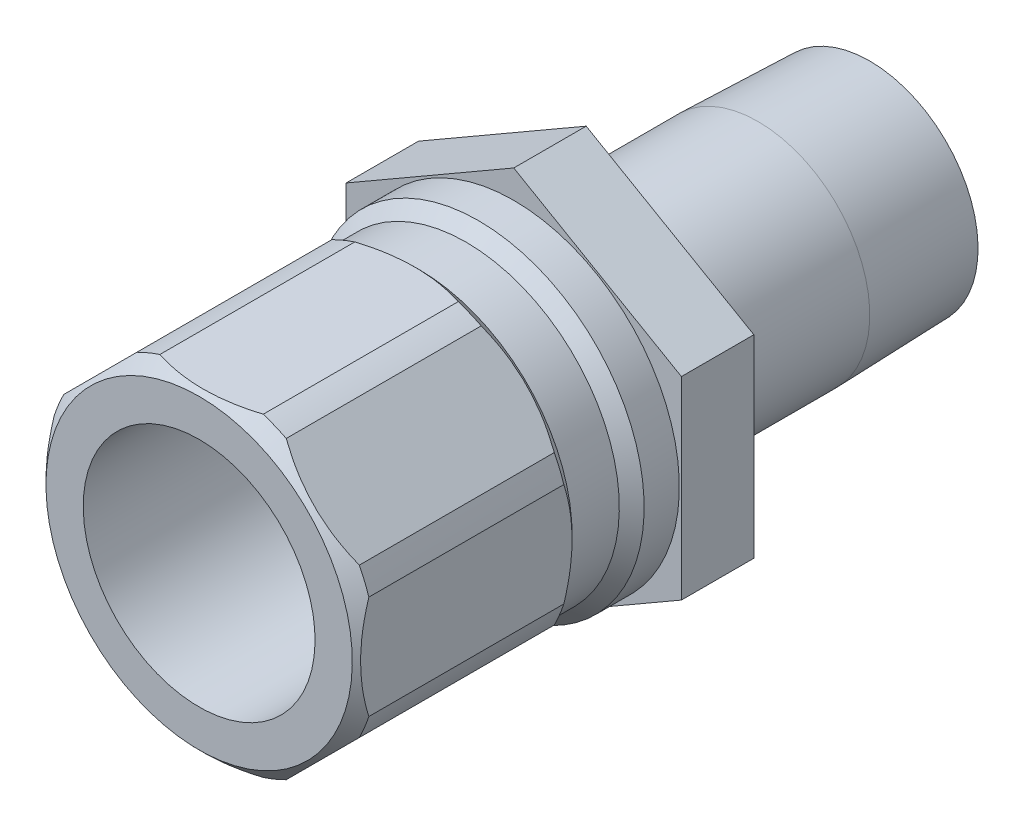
SolidWorks part; units mm, degrees
ref_plane "Front Plane" through (0, 0, 0) normal (0, 0, 1) x (1, 0, 0)
ref_plane "Top Plane" through (0, 0, 0) normal (0, 1, 0) x (1, 0, 0)
ref_plane "Right Plane" through (0, 0, 0) normal (1, 0, 0) x (0, 0, -1)
sketch "Sketch1" plane through (0, 0, 0) normal (1, 0, 0) x (0, 0, -1)
  line L0 (0, 0) -> (-22.479, 0) construction
  line L1 (-19.304, 7.112) -> (-19.304, 9.398)
  line L2 (-5.8166, 9.398) -> (-5.8166, 0) construction
  line L3 (-18.542, 10.16) -> (-6.5786, 10.16)
  line L4 (0, 6.858) -> (0, 0) construction
  line L5 (-5.8166, 9.398) -> (-2.921, 9.398)
  line L6 (-2.159, 10.16) -> (0, 10.16)
  line L7 (0, 10.16) -> (0, 6.858)
  line L8 (-5.8166, 9.398) -> (-6.5786, 10.16)
  line L9 (-2.921, 9.398) -> (-2.159, 10.16)
  line L10 (-19.304, 9.398) -> (-18.542, 10.16)
  line L11 (-0.2747, 4.7625) -> (21.844, 4.7625)
  line L12 (0, 6.858) -> (14.986, 6.858)
  line L13 (14.986, 6.858) -> (21.844, 6.6437)
  line L14 (21.844, 6.6437) -> (21.844, 4.7625)
  line L15 (4.445, 0) -> (0, 0) construction
  line L16 (-19.304, 7.112) -> (-1.524, 7.112)
  line L17 (-1.524, 7.112) -> (-0.2747, 4.7625)
  dimension "D1" = 19.304
  dimension "D2" = 2.8956
  dimension "D3" = 0.762
  dimension "D4" = 45
  dimension "D5" = 13.4874
  dimension "D6" = 45
  dimension "D7" = 1.79
  dimension "D8" = 6.858
  dimension "D9" = 41.148
  dimension "D10" = 3.175
  dimension "D11" = 4.445
  dimension "D12" = 9.525
  dimension "D13" = 13.716
  dimension "D14" = 20.32
  dimension "D15" = 118
  dimension "D16" = 14.224
  dimension "D17" = 17.78
revolve "Revolve1" add sketch "Sketch1" angle 360 about L0
sketch "Sketch2" plane through (0, 0, 0) normal (0, 0, 1) x (1, 0, 0)
  line L1 (-10.287, 5.9392) -> (-10.287, -5.9392)
  line L2 (-10.287, -5.9392) -> (0, -11.8784)
  line L3 (0, -11.8784) -> (10.287, -5.9392)
  line L4 (10.287, -5.9392) -> (10.287, 5.9392)
  line L5 (10.287, 5.9392) -> (0, 11.8784)
  line L6 (0, 11.8784) -> (-10.287, 5.9392)
  circle A0 centre (0, 0) radius 10.287 construction
  circle A1 centre (0, 0) radius 4.7625 construction
  circle A2 centre (0, 0) radius 4.7625
  dimension "D1" = 20.574
extrude "Boss-Extrude1" add sketch "Sketch2" against normal up to vertex (4.445 mm away)
sketch "Sketch3" plane through (0, 0, 0) normal (0, 0, 1) x (1, 0, 0)
  line L1 (9.652, -3.998) -> (9.652, 3.998)
  line L2 (9.652, 3.998) -> (3.998, 9.652)
  line L3 (3.998, 9.652) -> (-3.998, 9.652)
  line L4 (-3.998, 9.652) -> (-9.652, 3.998)
  line L5 (-9.652, 3.998) -> (-9.652, -3.998)
  line L6 (-9.652, -3.998) -> (-3.998, -9.652)
  line L7 (-3.998, -9.652) -> (3.998, -9.652)
  line L8 (3.998, -9.652) -> (9.652, -3.998)
  circle A0 centre (0, 0) radius 9.652 construction
  dimension "D1" = 19.304
extrude "Cut-Extrude2" cut sketch "Sketch3" along normal through all from vertex at 5.8166 flip side to cut
